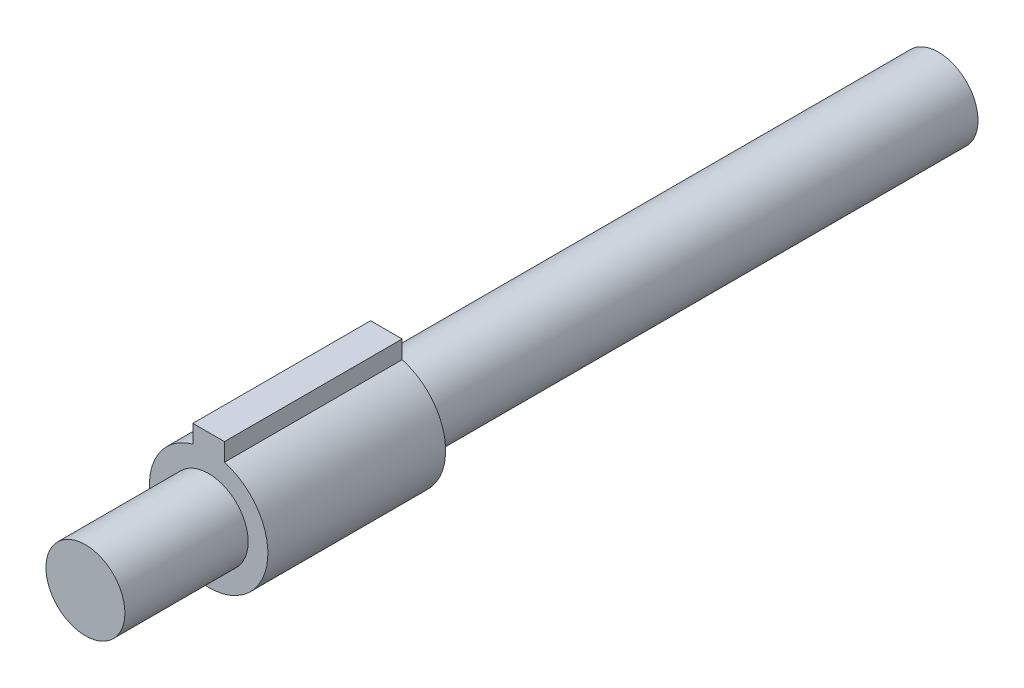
SolidWorks part; units mm, degrees
ref_plane "Front Plane" through (0, 0, 0) normal (0, 0, 1) x (1, 0, 0)
ref_plane "Top Plane" through (0, 0, 0) normal (0, 1, 0) x (1, 0, 0)
ref_plane "Right Plane" through (0, 0, 0) normal (1, 0, 0) x (0, 0, -1)
sketch "Sketch2" plane through (0, 0, 0) normal (0, 0, 1) x (1, 0, 0)
  line L0 (0, 0) -> (0, 32.371) construction
  line L2 (5.08, 24.13) -> (-5.08, 24.13)
  line L3 (5.08, 24.13) -> (5.08, 18.3602)
  line L5 (-5.08, 24.13) -> (-5.08, 18.3602)
  line L6 (5.08, 24.13) -> (-6.4147, 12.6353) construction
  line L7 (3.2532, 15.7968) -> (-5.08, 24.13) construction
  arc A0 (-5.08, 18.3602) -> (5.08, 18.3602) centre (0, 0) ccw
  point P3 (0, 19.05)
  dimension "D1" = 38.1
  dimension "D2" = 10.16
  dimension "D3" = 5.08
  dimension "D4" = 5.08
extrude "Boss-Extrude1" add sketch "Sketch2" along normal blind 57.15
sketch "Sketch3" plane through (0, 0, 57.15) normal (0, 0, 1) x (1, 0, 0)
  circle A0 centre (0, 0) radius 12.7
extrude "Boss-Extrude2" add sketch "Sketch3" along normal blind 39.624
sketch "Sketch4" plane through (0, 0, 0) normal (0, 0, -1) x (-1, 0, 0)
  circle A0 centre (0, 0) radius 12.7
extrude "Boss-Extrude3" add sketch "Sketch4" along normal blind 177.546
